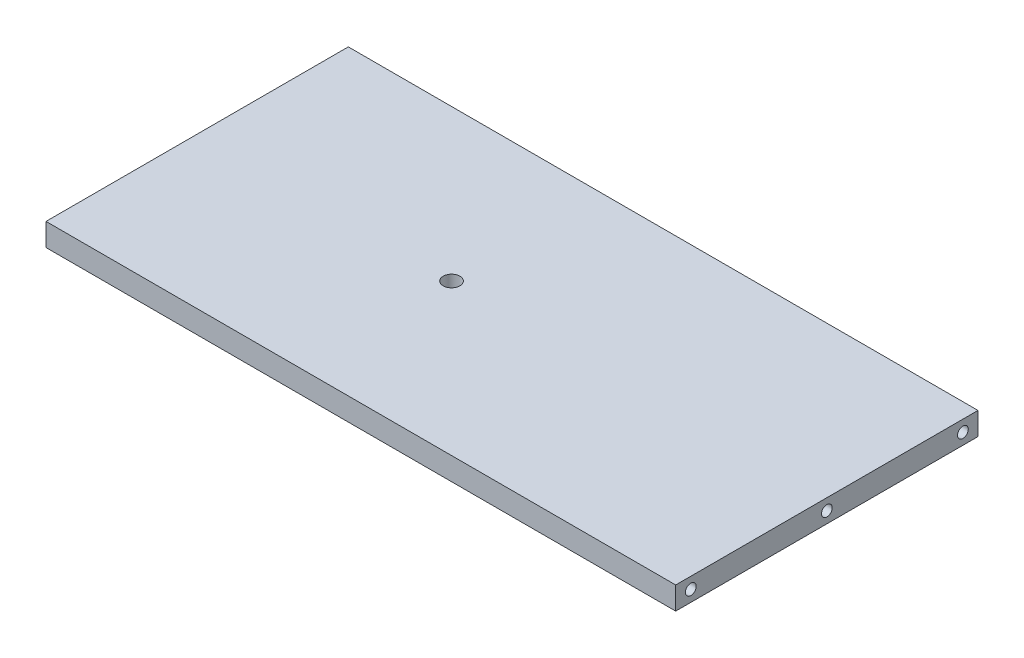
SolidWorks part; units mm, degrees
ref_plane "Front Plane" through (0, 0, 0) normal (0, 0, 1) x (1, 0, 0)
ref_plane "Top Plane" through (0, 0, 0) normal (0, 1, 0) x (1, 0, 0)
ref_plane "Right Plane" through (0, 0, 0) normal (1, 0, 0) x (0, 0, -1)
sketch "Sketch1" plane through (0, 0, 0) normal (0, 1, 0) x (1, 0, 0)
  line L1 (-66.1353, -31.75) -> (66.1352, -31.75)
  line L2 (-66.1353, -31.75) -> (-66.1353, 31.75)
  line L3 (-66.1353, 31.75) -> (66.1352, 31.75)
  line L4 (66.1352, -31.75) -> (66.1352, 31.75)
  line L5 (-66.1353, -31.75) -> (66.1352, 31.75) construction
  line L6 (-66.1353, 31.75) -> (66.1352, -31.75) construction
  point P0 (0, 0)
  dimension "D1" = 132.2705
  dimension "D2" = 63.5
extrude "Boss-Extrude1" add sketch "Sketch1" along normal blind 4.7625
sketch "Sketch2" plane through (-66.1353, 0, 0) normal (-1, 0, 0) x (0, 0, 1)
  line L0 (0, 4.7625) -> (0, 0) construction
  line L1 (-31.75, 4.7625) -> (31.75, 4.7625) construction
  line L2 (-31.75, 4.7625) -> (-31.75, 0) construction
  line L3 (-31.75, 2.3813) -> (31.75, 2.3813) construction
  line L4 (31.75, 4.7625) -> (31.75, 0) construction
  circle A0 centre (-28.575, 2.3813) radius 1.1303
  circle A1 centre (28.575, 2.3813) radius 1.1303
  circle A2 centre (0, 2.3813) radius 1.1303
  dimension "D1" = 2.2606
  dimension "D2" = 3.175
extrude "Cut-Extrude1" cut sketch "Sketch2" against normal blind 10.16
mirror "Mirror1" about plane through (0, 0, 0) normal (1, 0, 0) of "Cut-Extrude1"
sketch "Sketch3" plane through (0, 4.7625, 0) normal (0, 1, 0) x (1, 0, 0)
  circle A0 centre (-12.7, 0) radius 1.759
  dimension "D1" = 3.5179
  dimension "D2" = 12.7
extrude "Cut-Extrude2" cut sketch "Sketch3" against normal through all
